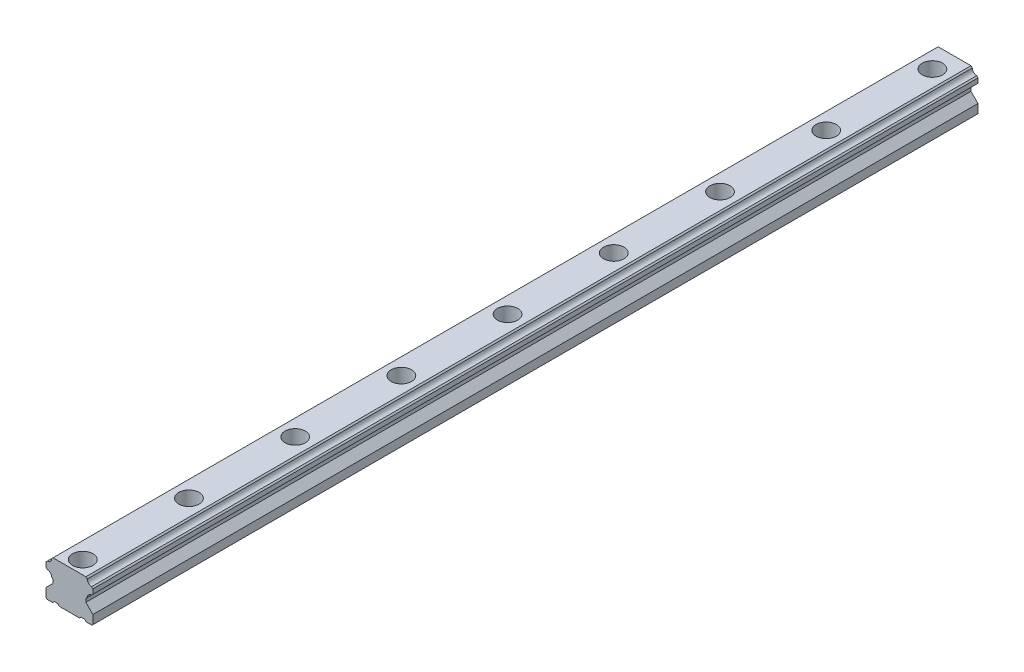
SolidWorks part; units mm, degrees
ref_plane "Front Plane" through (0, 0, 0) normal (0, 0, 1) x (1, 0, 0)
ref_plane "Top Plane" through (0, 0, 0) normal (0, 1, 0) x (1, 0, 0)
ref_plane "Right Plane" through (0, 0, 0) normal (1, 0, 0) x (0, 0, -1)
sketch "Sketch2" plane through (0, 0, 0) normal (0, 0, 1) x (1, 0, 0)
  line L0 (-11.2249, -22.0222) -> (11.4894, -22.0222)
  line L1 (11.4894, -22.0222) -> (13.2561, -20.2555)
  line L2 (13.2561, -20.2555) -> (17.2942, -20.2555)
  line L3 (17.2942, -20.2555) -> (19.0608, -22.0222)
  line L4 (19.0608, -22.0222) -> (25.6323, -22.0222)
  line L5 (25.6323, -22.0222) -> (26.6323, -21.0222)
  line L6 (26.6323, -21.0222) -> (26.6323, -11.0222)
  line L7 (26.6323, -11.0222) -> (18.6823, -3.0722)
  line L8 (18.6823, -3.0722) -> (18.6823, 0.8278)
  line L9 (18.6823, 0.8278) -> (20.1784, 2.3239)
  line L10 (25.1361, 7.2816) -> (26.6323, 8.7778)
  line L11 (26.6323, 8.7778) -> (26.6323, 14.0278)
  line L12 (26.6323, 14.0278) -> (25.1361, 15.5239)
  line L13 (20.1784, 20.4816) -> (18.6823, 21.9778)
  line L14 (18.6823, 21.9778) -> (-18.4177, 21.9778)
  line L15 (-18.4177, 21.9778) -> (-19.9139, 20.4816)
  line L16 (-24.8716, 15.5239) -> (-26.3677, 14.0278)
  line L17 (-26.3677, 14.0278) -> (-26.3677, 8.7778)
  line L18 (-26.3677, 8.7778) -> (-24.8716, 7.2816)
  line L19 (-19.9139, 2.3239) -> (-18.4177, 0.8278)
  line L20 (-18.4177, 0.8278) -> (-18.4177, -3.0722)
  line L21 (-18.4177, -3.0722) -> (-26.3677, -11.0222)
  line L22 (-26.3677, -11.0222) -> (-26.3677, -21.0222)
  line L23 (-26.3677, -21.0222) -> (-25.3677, -22.0222)
  line L24 (-25.3677, -22.0222) -> (-18.7963, -22.0222)
  line L25 (-18.7963, -22.0222) -> (-17.0296, -20.2555)
  line L26 (-17.0296, -20.2555) -> (-12.9915, -20.2555)
  line L27 (-12.9915, -20.2555) -> (-11.2249, -22.0222)
  arc A0 (25.1361, 7.2816) -> (20.1784, 2.3239) centre (25.468, 1.992) ccw
  arc A1 (20.1784, 20.4816) -> (25.1361, 15.5239) centre (25.468, 20.8135) ccw
  arc A2 (-24.8716, 15.5239) -> (-19.9139, 20.4816) centre (-25.2035, 20.8135) ccw
  arc A3 (-19.9139, 2.3239) -> (-24.8716, 7.2816) centre (-25.2035, 1.992) ccw
extrude "Boss-Extrude1" add sketch "Sketch2" along normal blind 1000
sketch "Sketch3" plane through (0, 21.9778, 0) normal (0, 1, 0) x (1, 0, 0)
  line L0 (26.6323, -1000) -> (26.6323, 0) construction
  line L2 (18.6823, 0) -> (-18.4177, 0) construction
  point P0 (0.1323, -25)
  dimension "D1" = 26.5
  dimension "D2" = 25
hole_wizard "CBORE for M16 Hex Head Bolt1" positions "Sketch3" profile "Sketch4" counterbore size "M16" standard "DIN"
sketch "Sketch4" plane through (0.1323, 21.9778, 25) normal (1, 0, 0) x (0, 0, 1)
  line L0 (0, 0) -> (0, 44)
  line L1 (0, 44) -> (8, 44)
  line L3 (8, 44) -> (8, 20)
  line L4 (8, 20) -> (11.5, 20)
  line L5 (11.5, 20) -> (11.5, 0)
  line L7 (11.5, 0) -> (0, 0)
  line L11 (0, -6.35) -> (0, 107.95) construction
  dimension "Thru Hole Dia." = 16
  dimension "Thru Hole Depth" = 44
  dimension "C'Bore Dia." = 23
  dimension "C'Bore Depth" = 20
other "Fill Pattern1" parameters "D5"=0, "D6"=0, "D1"=120, "D2"=60, "D3"=0, "D9"=9, "D7"=9, "D8"=2
